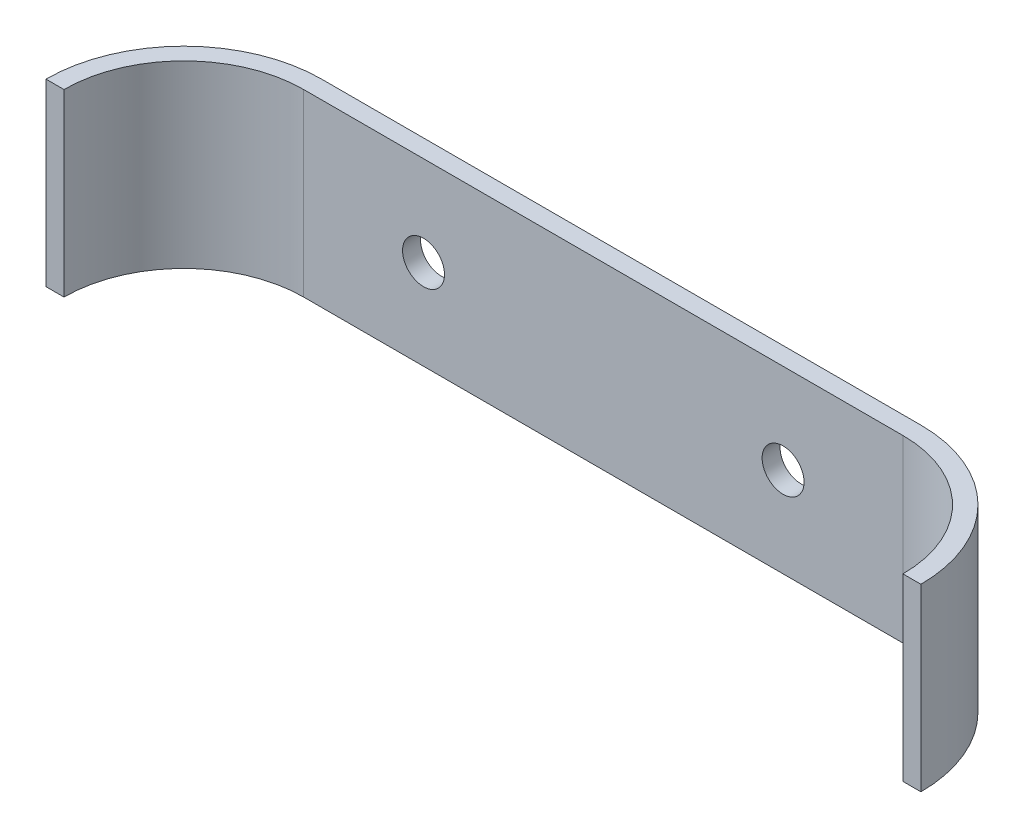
SolidWorks part; units mm, degrees
ref_plane "Front Plane" through (0, 0, 0) normal (0, 0, 1) x (1, 0, 0)
ref_plane "Top Plane" through (0, 0, 0) normal (0, 1, 0) x (1, 0, 0)
ref_plane "Right Plane" through (0, 0, 0) normal (1, 0, 0) x (0, 0, -1)
sketch "Sketch1" plane through (0, 0, 0) normal (0, 1, 0) x (1, 0, 0)
  line L0 (0, 0) -> (50, 0) construction
  line L1 (0, 10) -> (50, 10)
  line L2 (50, 0) -> (60, 0) construction
  line L3 (0, 0) -> (-10, 0) construction
  line L4 (0, 11.5) -> (50, 11.5)
  line L5 (-11.5, 0) -> (-10, 0)
  line L6 (60, 0) -> (61.5, 0)
  arc A0 (0, 10) -> (-10, 0) centre (0, 0) ccw
  arc A1 (60, 0) -> (50, 10) centre (50, 0) ccw
  arc A2 (0, 11.5) -> (-11.5, 0) centre (0, 0) ccw
  arc A3 (61.5, 0) -> (50, 11.5) centre (50, 0) ccw
  dimension "D1" = 10
  dimension "D2" = 50
  dimension "D3" = 1.5
extrude "Extrude1" add sketch "Sketch1" along normal blind 15
sketch "Sketch2" plane through (0, 0, -10) normal (0, 0, 1) x (1, 0, 0)
  line L0 (0, 7.5) -> (50, 7.5) construction
  line L1 (0, 15) -> (0, 0) construction
  line L2 (50, 15) -> (50, 0) construction
  line L3 (25, 15) -> (25, 0) construction
  line L4 (0, 15) -> (50, 15) construction
  line L5 (0, 0) -> (50, 0) construction
  circle A0 centre (10, 7.5) radius 1.75
  circle A1 centre (40, 7.5) radius 1.75
  dimension "D1" = 3.5
  dimension "D2" = 3.5
  dimension "D3" = 15
  dimension "D4" = 15
extrude "Extrude2" cut sketch "Sketch2" against normal through all
